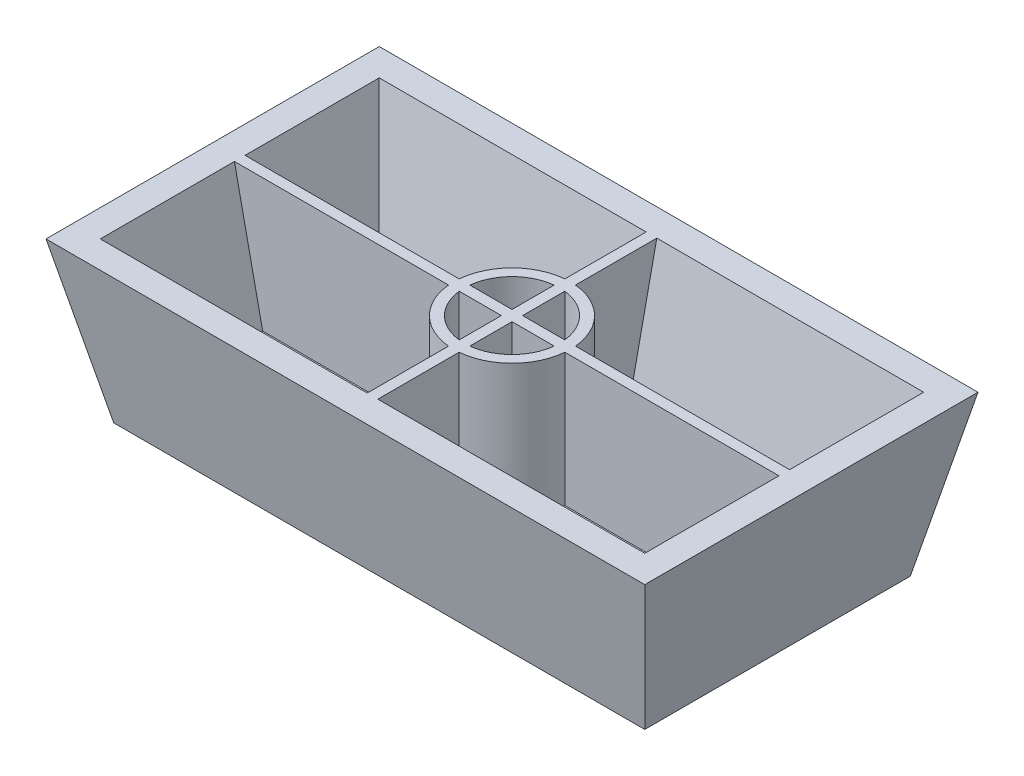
SolidWorks part; units mm, degrees
ref_plane "Front Plane" through (0, 0, 0) normal (0, 0, 1) x (1, 0, 0)
ref_plane "Top Plane" through (0, 0, 0) normal (0, 1, 0) x (1, 0, 0)
ref_plane "Right Plane" through (0, 0, 0) normal (1, 0, 0) x (0, 0, -1)
sketch "Sketch1" plane through (0, 0, 0) normal (0, 1, 0) x (1, 0, 0)
  line L1 (0, 0) -> (100, 0)
  line L2 (0, 0) -> (0, 50)
  line L3 (0, 50) -> (100, 50)
  line L4 (100, 0) -> (100, 50)
  dimension "D1" = 50
  dimension "D2" = 100
extrude "Extrude1" add sketch "Sketch1" along normal blind 30 draft 12
shell "Shell1" thickness 5
sketch "Sketch4" plane through (0, 30, 0) normal (0, 1, 0) x (-1, 0, 0)
  line L0 (1.265, -25) -> (-101.265, -25)
  line L1 (1.265, -51.265) -> (1.265, 1.265) construction
  line L2 (-101.265, 1.265) -> (-101.265, -51.265) construction
  line L3 (-50, -51.265) -> (-50, 1.265)
  line L5 (1.265, 1.265) -> (-101.265, 1.265) construction
  line L6 (-101.265, -51.265) -> (1.265, -51.265) construction
  circle A0 centre (-50, -25) radius 10
  dimension "D1" = 20
rib "Rib2" sketch "Sketch4" sketch "Sketch4" thickness 2 extrusion direction normal to sketch draft on no parameters "D1"=2
